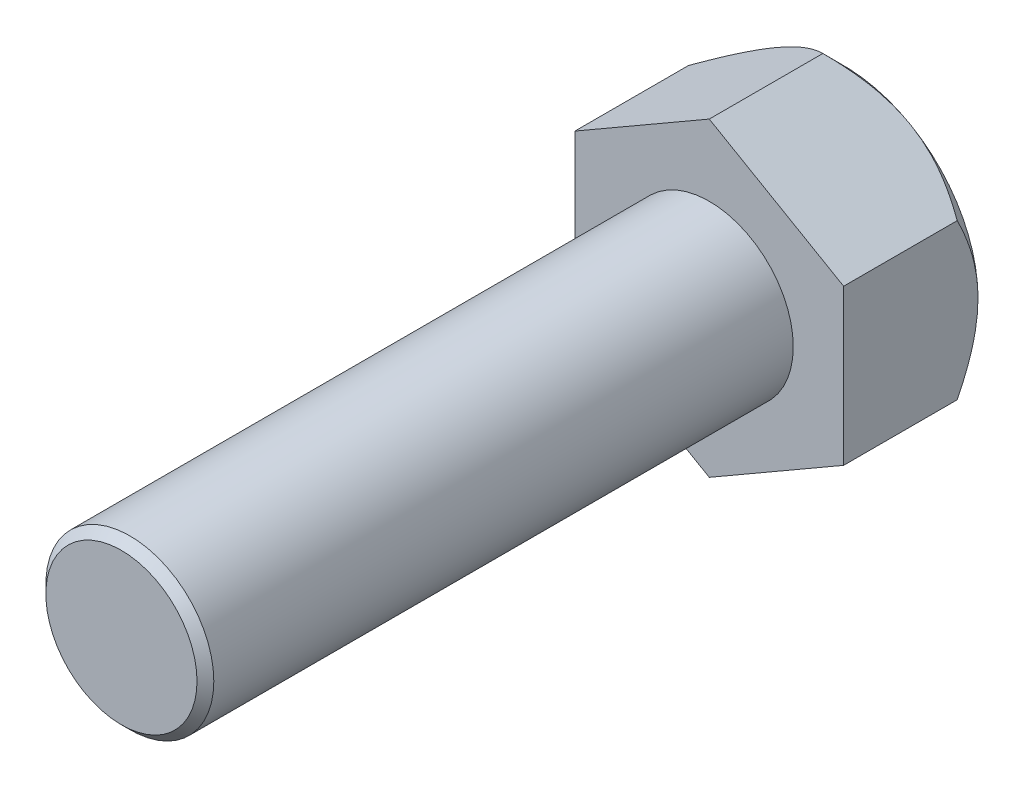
SolidWorks part; units mm, degrees
ref_plane "Płaszczyzna przednia" through (0, 0, 0) normal (0, 0, 1) x (1, 0, 0)
ref_plane "Płaszczyzna górna" through (0, 0, 0) normal (0, 1, 0) x (1, 0, 0)
ref_plane "Płaszczyzna prawa" through (0, 0, 0) normal (1, 0, 0) x (0, 0, -1)
sketch "Szkic1" plane through (0, 0, 0) normal (0, 0, 1) x (1, 0, 0)
  circle A0 centre (0, 0) radius 5
  dimension "D1" = 10
extrude "Dodanie-wyciągnięcie1" add sketch "Szkic1" along normal blind 35
chamfer "Sfazowanie1" distance 0.5 angle 45 1 edges at (5, 0, 35)
sketch "Szkic2" plane through (0, 0, 0) normal (0, 0, -1) x (-1, 0, 0)
  line L1 (-8, 4.6188) -> (-8, -4.6188)
  line L2 (-8, -4.6188) -> (0, -9.2376)
  line L3 (0, -9.2376) -> (8, -4.6188)
  line L4 (8, -4.6188) -> (8, 4.6188)
  line L5 (8, 4.6188) -> (0, 9.2376)
  line L6 (0, 9.2376) -> (-8, 4.6188)
  circle A0 centre (0, 0) radius 8 construction
  dimension "D1" = 16
extrude "Dodanie-wyciągnięcie2" add sketch "Szkic2" along normal blind 8
sketch "Szkic3" plane through (0, 0, -8) normal (0, 0, -1) x (-1, 0, 0)
  line L0 (8, 4.6188) -> (0, 9.2376) construction
  circle A0 centre (0, 0) radius 8
extrude "Wytnij-wyciągnięcie1" cut sketch "Szkic3" against normal through all draft 45 flip side to cut
